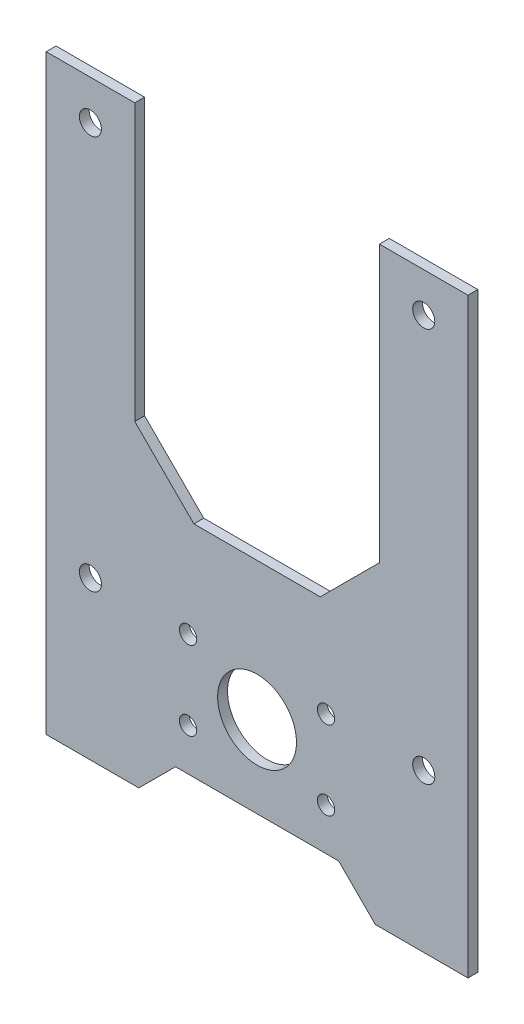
SolidWorks part; units mm, degrees
ref_plane "Front Plane" through (0, 0, 0) normal (0, 0, 1) x (1, 0, 0)
ref_plane "Top Plane" through (0, 0, 0) normal (0, 1, 0) x (1, 0, 0)
ref_plane "Right Plane" through (0, 0, 0) normal (1, 0, 0) x (0, 0, -1)
sketch "Sketch1" plane through (0, 0, 0) normal (0, 0, 1) x (1, 0, 0)
  line L1 (-33.9725, -47.625) -> (33.9725, -47.625)
  line L2 (-33.9725, -47.625) -> (-33.9725, 47.625)
  line L3 (-33.9725, 47.625) -> (33.9725, 47.625)
  line L4 (33.9725, -47.625) -> (33.9725, 47.625)
  line L5 (0, 47.625) -> (0, -47.625) construction
  line L6 (-33.9725, 0) -> (33.9725, 0) construction
  point P0 (0, 0)
  dimension "D1" = 67.945
  dimension "D2" = 95.25
base flange "Base-Flange1" sketch "Sketch1" thickness 1.5875 reverse thickness direction no parameters "D1"=0.7366
sketch "Sketch2" plane through (0, 0, 0) normal (0, 0, 1) x (1, 0, 0)
  circle A0 centre (26.8478, -22.225) radius 1.778 construction
  circle A1 centre (-26.8478, -22.225) radius 1.778 construction
  circle A2 centre (-26.8478, 41.275) radius 1.778 construction
  circle A3 centre (26.8478, 41.275) radius 1.778 construction
  circle A4 centre (26.8478, -22.225) radius 1.778
  circle A5 centre (-26.8478, -22.225) radius 1.778
  circle A20 centre (-26.8478, 41.275) radius 1.778
  circle A21 centre (26.8478, 41.275) radius 1.778
extrude "Cut-Extrude1" cut sketch "Sketch2" against normal through all
sketch "Sketch3" plane through (0, 0, 0) normal (0, 0, 1) x (1, 0, 0)
  line L0 (0, 47.625) -> (0, -47.625) construction
  line L4 (33.9725, 47.625) -> (-33.9725, 47.625) construction
  line L5 (-33.9725, -47.625) -> (33.9725, -47.625) construction
  circle A7 centre (0, -28.575) radius 6.35
  dimension "D1" = 12.7
  dimension "D2" = 19.05
extrude "Cut-Extrude2" cut sketch "Sketch3" against normal through all
sketch "Sketch4" plane through (0, 0, -1.5875) normal (0, 0, -1) x (-1, 0, 0)
  line L0 (13.1383, -41.7133) -> (19.05, -47.625) construction
  line L1 (-19.05, -47.625) -> (-13.1383, -41.7133) construction
  line L2 (-13.1383, -41.7133) -> (13.1383, -41.7133) construction
  line L3 (13.1383, -41.7133) -> (19.05, -47.625)
  line L4 (-19.05, -47.625) -> (-13.1383, -41.7133)
  line L5 (-13.1383, -41.7133) -> (13.1383, -41.7133)
  line L6 (-19.05, -47.625) -> (19.05, -47.625)
  line L7 (19.704, 47.625) -> (19.704, 3.175)
  line L8 (19.704, -47.625) -> (19.704, 130.175) construction
  line L9 (-33.9725, 47.625) -> (33.9725, 47.625) construction
  line L10 (19.704, 3.175) -> (10.179, -6.35)
  line L11 (10.179, -6.35) -> (-10.179, -6.35)
  line L12 (-19.704, 3.175) -> (-19.704, 47.625)
  line L13 (-19.704, 130.175) -> (-19.704, -47.625) construction
  line L14 (-19.704, 3.175) -> (-10.179, -6.35)
  line L15 (19.704, 47.625) -> (-19.704, 47.625)
  point P12 (0, -6.35)
  dimension "D1" = 45
  dimension "D2" = 44.45
  dimension "D3" = 53.975
extrude "Cut-Extrude3" cut sketch "Sketch4" against normal blind 2.54 and the other way through all
sketch "Sketch5" plane through (0, 0, 0) normal (0, 0, 1) x (1, 0, 0)
  line L1 (-11.1125, -34.925) -> (11.1125, -34.925) construction
  line L2 (-11.1125, -34.925) -> (-11.1125, -22.225) construction
  line L3 (-11.1125, -22.225) -> (11.1125, -22.225) construction
  line L4 (11.1125, -34.925) -> (11.1125, -22.225) construction
  line L5 (0, -22.225) -> (0, -34.925) construction
  line L6 (-11.1125, -28.575) -> (11.1125, -28.575) construction
  circle A0 centre (11.1125, -22.225) radius 1.397
  circle A1 centre (11.1125, -34.925) radius 1.397
  circle A2 centre (-11.1125, -22.225) radius 1.397
  circle A3 centre (-11.1125, -34.925) radius 1.397
  point P0 (0, -28.575)
  point P1 (0, -28.575)
  dimension "D1" = 2.794
  dimension "D2" = 12.7
  dimension "D3" = 22.225
extrude "Cut-Extrude4" cut sketch "Sketch5" against normal through all
sketch "Bend-Lines1" [suppressed] plane through (0, 0, 0) normal (0, 1, 0) x (1, 0, 0)
sketch "Bounding-Box1" [suppressed] plane through (0, 0, 0) normal (0, 1, 0) x (1, 0, 0)
sheet metal parameters "Sheet-Metal1" thickness 1.5875 parameters "D1"=0.7366
flat pattern "Flat-Pattern1"
sketch "Bend-Lines2" plane through (0, 0, 0) normal (0, 1, 0) x (1, 0, 0)
sketch3d "Bounding-Box2" [suppressed]
  line L0 (36.5125, 44.45, 0) -> (36.5125, -44.45, 0) construction
  line L1 (-36.5125, 44.45, 0) -> (-36.5125, -44.45, 0) construction
  line L2 (36.5125, 44.45, 0) -> (-36.5125, 44.45, 0) construction
  line L3 (36.5125, -44.45, 0) -> (-36.5125, -44.45, 0) construction
sheet metal parameters "Sheet-Metal2" thickness 1.5875 parameters "D1"=0.7366
flat pattern "Flat-Pattern1"
sketch "Bend-Lines2" plane through (0, 0, 0) normal (0, 1, 0) x (1, 0, 0)
sketch3d "Bounding-Box2" [suppressed]
  line L0 (36.5125, 44.45, 0) -> (36.5125, -44.45, 0) construction
  line L1 (-36.5125, 44.45, 0) -> (-36.5125, -44.45, 0) construction
  line L2 (36.5125, 44.45, 0) -> (-36.5125, 44.45, 0) construction
  line L3 (36.5125, -44.45, 0) -> (-36.5125, -44.45, 0) construction
sheet metal parameters "Sheet-Metal3" thickness 1.5875 parameters "D1"=0.7366
flat pattern "Flat-Pattern1"
sketch "Bend-Lines2" plane through (0, 0, 0) normal (0, 1, 0) x (1, 0, 0)
sketch3d "Bounding-Box2" [suppressed]
  line L0 (31.75, 47.625, 0) -> (31.75, -47.625, 0) construction
  line L1 (-31.75, 47.625, 0) -> (-31.75, -47.625, 0) construction
  line L2 (31.75, 47.625, 0) -> (-31.75, 47.625, 0) construction
  line L3 (31.75, -47.625, 0) -> (-31.75, -47.625, 0) construction
sheet metal parameters "Sheet-Metal4" thickness 1.5875 parameters "D1"=0.7366
flat pattern "Flat-Pattern1"
sketch "Bend-Lines2" plane through (0, 0, 0) normal (0, 1, 0) x (1, 0, 0)
sketch3d "Bounding-Box2" [suppressed]
  line L0 (31.75, 47.625, 0) -> (31.75, -47.625, 0) construction
  line L1 (-31.75, 47.625, 0) -> (-31.75, -47.625, 0) construction
  line L2 (31.75, 47.625, 0) -> (-31.75, 47.625, 0) construction
  line L3 (31.75, -47.625, 0) -> (-31.75, -47.625, 0) construction
sheet metal parameters "Sheet-Metal5" thickness 1.5875 parameters "D1"=0.7366
flat pattern "Flat-Pattern1"
sketch "Bend-Lines2" plane through (0, 0, 0) normal (0, 1, 0) x (1, 0, 0)
sketch3d "Bounding-Box2" [suppressed]
  line L0 (33.9725, 47.625, 0) -> (33.9725, -47.625, 0) construction
  line L1 (-33.9725, 47.625, 0) -> (-33.9725, -47.625, 0) construction
  line L2 (33.9725, 47.625, 0) -> (-33.9725, 47.625, 0) construction
  line L3 (33.9725, -47.625, 0) -> (-33.9725, -47.625, 0) construction
